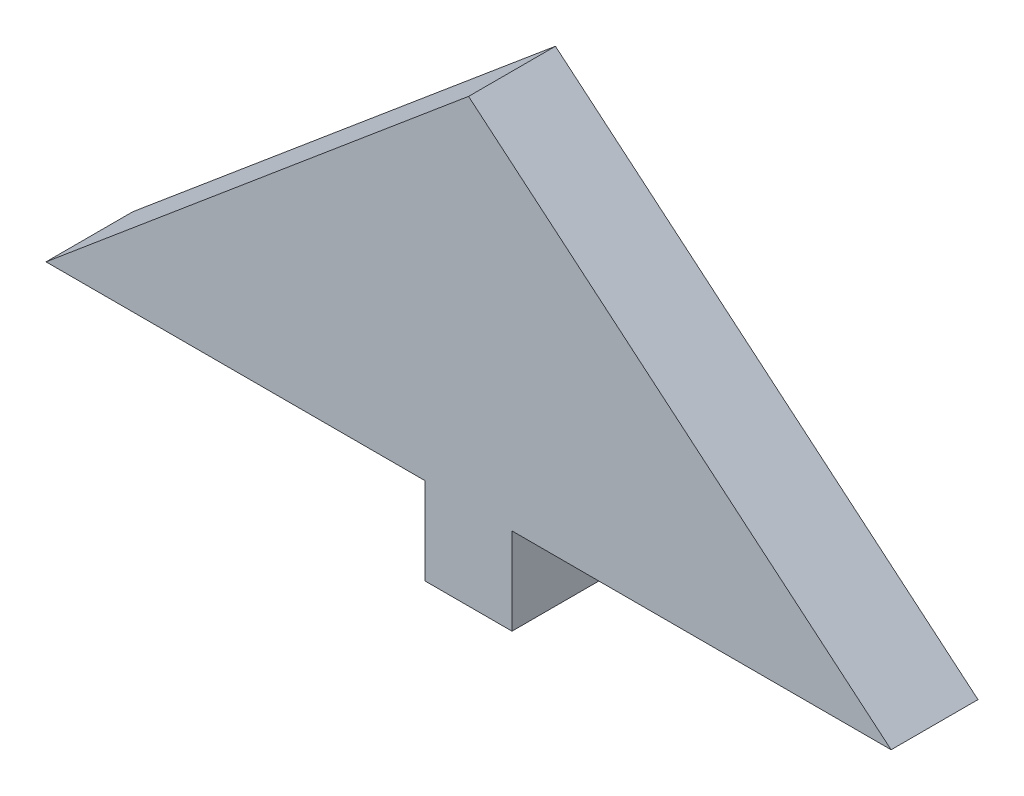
SolidWorks part; units mm, degrees
ref_plane "Front Plane" through (0, 0, 0) normal (0, 0, 1) x (1, 0, 0)
ref_plane "Top Plane" through (0, 0, 0) normal (0, 1, 0) x (1, 0, 0)
ref_plane "Right Plane" through (0, 0, 0) normal (1, 0, 0) x (0, 0, -1)
sketch "Sketch1" plane through (0, 0, 0) normal (0, 0, 1) x (1, 0, 0)
  line L0 (-14.5931, 3) -> (0, 15.2451)
  line L1 (0, 15.2451) -> (14.5931, 3)
  line L2 (14.5931, 3) -> (-14.5931, 3)
  line L4 (-1.5, 3) -> (1.5, 3)
  line L5 (-1.5, 3) -> (-1.5, 0)
  line L6 (-1.5, 0) -> (1.5, 0)
  line L7 (1.5, 3) -> (1.5, 0)
  point P7 (0, 0)
  dimension "D1" = 3
  dimension "D2" = 40
  dimension "D3" = 19.05
extrude "Boss-Extrude1" add sketch "Sketch1" along normal mid plane 3 contours L7 L2 L5 L6 | L2 L1 L0
